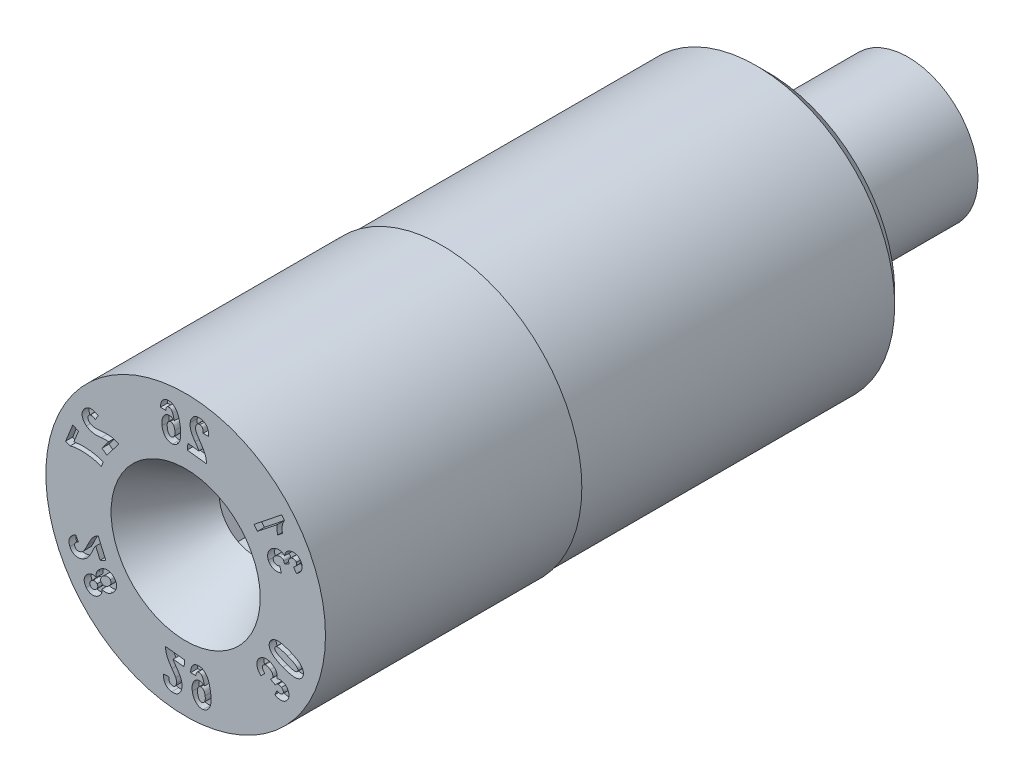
SolidWorks part; units mm, degrees
other "<M6L12-SetScrew>-<Chamfer1>"
ref_plane "Front Plane" through (0, 0, 0) normal (0, 0, 1) x (1, 0, 0)
ref_plane "Top Plane" through (0, 0, 0) normal (0, 1, 0) x (1, 0, 0)
ref_plane "Right Plane" through (0, 0, 0) normal (1, 0, 0) x (0, 0, -1)
sketch "Sketch1" plane through (0, 0, 0) normal (1, 0, 0) x (0, 0, -1)
  line L0 (0, 3.2) -> (2.9445, 1.5)
  line L2 (0, 6) -> (0, 3.2)
  line L3 (24.425, 6) -> (0, 6)
  line L4 (-3.7979, 0) -> (49996.2021, 0) construction
  line L8 (19, 1.5) -> (2.9445, 1.5)
  line L12 (25, 3) -> (25, 5.425)
  line L16 (25, 5.425) -> (24.425, 6)
  line L17 (25, 3) -> (19, 3)
  line L18 (19, 1.5) -> (19, 3)
  dimension "D1" = 25
  dimension "D2" = 45
  dimension "D3" = 0.575
  dimension "D4" = 12
  dimension "D5" = 30
  dimension "D6" = 3.2
  dimension "D7" = 3
  dimension "D8" = 6
  dimension "D9" = 6
revolve "Revolve1" add sketch "Sketch1" angle 360 about L4
sketch "Sketch5" plane through (0, 0, 0) normal (1, 0, 0) x (0, 0, -1)
  line L0 (0, 0) -> (50000, 0) construction
  line L1 (0, 6) -> (0, -6) construction
  line L2 (11, 5.935) -> (25, 5.935)
  line L3 (11, 5.935) -> (11, 6.935)
  line L4 (11, 6.935) -> (25, 6.935)
  line L5 (25, 5.935) -> (25, 6.935)
  line L6 (25, -5.425) -> (25, 5.425) construction
  line L7 (24.425, 6) -> (0, 6) construction
  dimension "D1" = 11
  dimension "D2" = 0.065
  dimension "D3" = 1
revolve "Cut-Revolve1" cut sketch "Sketch5" angle 360 about L0
sketch "Sketch2" plane through (0, 0, 0) normal (0, 0, 1) x (1, 0, 0)
  line L0 (0, 0) -> (0, 6) construction
  line L1 (0, 0) -> (5.1962, 3) construction
  line L2 (0, 0) -> (5.1962, -3) construction
  line L3 (0, 0) -> (0, -6) construction
  line L4 (0, 0) -> (-5.1962, -3) construction
  line L5 (0, 0) -> (-5.1962, 3) construction
  arc A0 (0.9318, 3.8257) -> (2.2256, 3.2482) centre (0, 0) ccw construction
  circle A1 centre (0, 0) radius 6 construction
  text T0 "26    27    28    29    30    31" font "Arial Narrow" height 1.5
  point P19 (0, 0)
  dimension "D1" = 7.875
  dimension "D2" = 6
extrude "Cut-Extrude1" cut sketch "Sketch2" against normal blind 0.3
ref_plane "Plane1" through (0, 0, -2.9445) normal (0, 0, 1) x (1, 0, 0)
sketch "Sketch6" plane through (0, 0, -2.9445) normal (0, 0, 1) x (1, 0, 0)
  line L1 (1.7321, 0) -> (0.866, 1.5)
  line L2 (0.866, 1.5) -> (-0.866, 1.5)
  line L3 (-0.866, 1.5) -> (-1.7321, 0)
  line L4 (-1.7321, 0) -> (-0.866, -1.5)
  line L5 (-0.866, -1.5) -> (0.866, -1.5)
  line L6 (0.866, -1.5) -> (1.7321, 0)
  circle A0 centre (0, 0) radius 1.5 construction
  circle A1 centre (0, 0) radius 1.5 construction
  point P1 (0, 1.5)
extrude "Cut-Extrude2" cut sketch "Sketch6" against normal blind 3
inserted part "M6L12-SetScrew"
move or copy body "Body-Move/Copy2" placed by mates yes
other "Distance1" parameters "D1"=6
